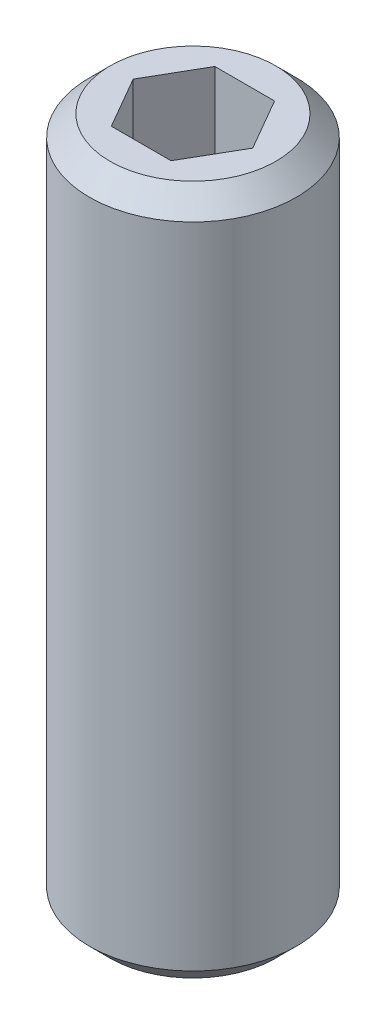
SolidWorks part; units mm, degrees
ref_plane "Plan de face" through (0, 0, 0) normal (0, 0, 1) x (1, 0, 0)
ref_plane "Plan de dessus" through (0, 0, 0) normal (0, 1, 0) x (1, 0, 0)
ref_plane "Plan de droite" through (0, 0, 0) normal (1, 0, 0) x (0, 0, -1)
sketch "Esquisse1" plane through (0, 0, 0) normal (0, 1, 0) x (1, 0, 0)
  circle A0 centre (0, 0) radius 3
  dimension "D1" = 6
extrude "Extrusion1" add sketch "Esquisse1" against normal blind 20
sketch "Esquisse2" plane through (0, 0, 0) normal (0, 1, 0) x (-1, 0, 0)
  line L1 (0.866, -1.5) -> (1.7321, 0)
  line L2 (1.7321, 0) -> (0.866, 1.5)
  line L3 (0.866, 1.5) -> (-0.866, 1.5)
  line L4 (-0.866, 1.5) -> (-1.7321, 0)
  line L5 (-1.7321, 0) -> (-0.866, -1.5)
  line L6 (-0.866, -1.5) -> (0.866, -1.5)
  circle A0 centre (0, 0) radius 1.5 construction
  dimension "D1" = 3
extrude "Enlèv. mat.-Extru.1" cut sketch "Esquisse2" against normal blind 3
chamfer "Chanfrein1" distance 0.6 angle 45 2 edges at (0, 0, 3) (0, -20, 3)
